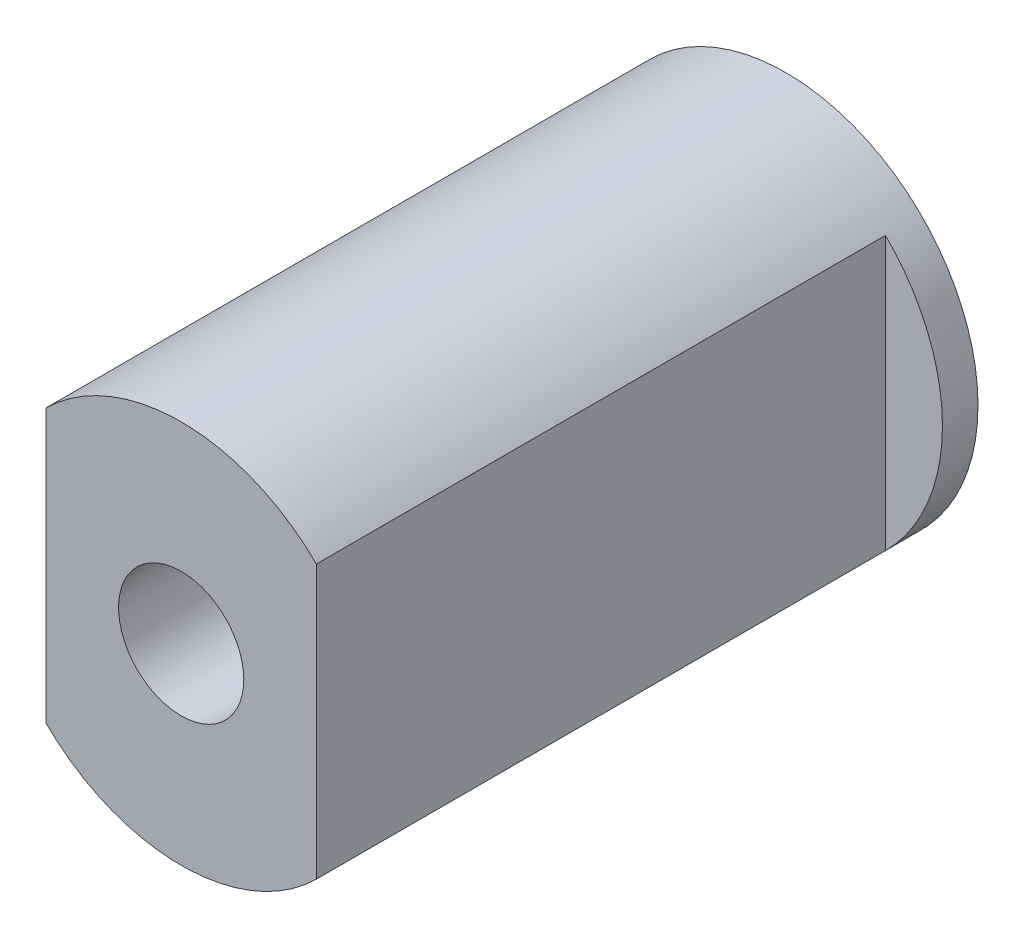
SolidWorks part; units mm, degrees
ref_plane "Front" through (0, 0, 0) normal (0, 0, 1) x (1, 0, 0)
ref_plane "Top" through (0, 0, 0) normal (0, 1, 0) x (1, 0, 0)
ref_plane "Right" through (0, 0, 0) normal (1, 0, 0) x (0, 0, -1)
sketch "Sketch1" plane through (0, 0, 0) normal (0, 0, 1) x (1, 0, 0)
  circle A0 centre (0, 0) radius 2.7
  dimension "D1" = 5.4
extrude "Extrude1" add sketch "Sketch1" along normal blind 0.5
sketch "Sketch2" plane through (0, 0, 0.5) normal (0, 0, 1) x (1, 0, 0)
  line L0 (0, -3.667) -> (0, 3.8813) construction
  line L1 (1.9, -1.9183) -> (1.9, 1.9183)
  line L2 (-1.9, -1.9183) -> (-1.9, 1.9183)
  circle A0 centre (0, 0) radius 2.7 construction
  arc A1 (1.9, 1.9183) -> (-1.9, 1.9183) centre (0, 0) ccw
  arc A2 (-1.9, -1.9183) -> (1.9, -1.9183) centre (0, 0) ccw
  point P6 (0, 0)
  dimension "D1" = 3.8
extrude "Extrude2" add sketch "Sketch2" along normal blind 8
sketch "Sketch3" plane through (0, 0, 8.5) normal (0, 0, 1) x (1, 0, 0)
  circle A0 centre (0, 0) radius 0.88
extrude "Cut-Extrude1" cut sketch "Sketch3" against normal up to surface (8.5 mm away)
